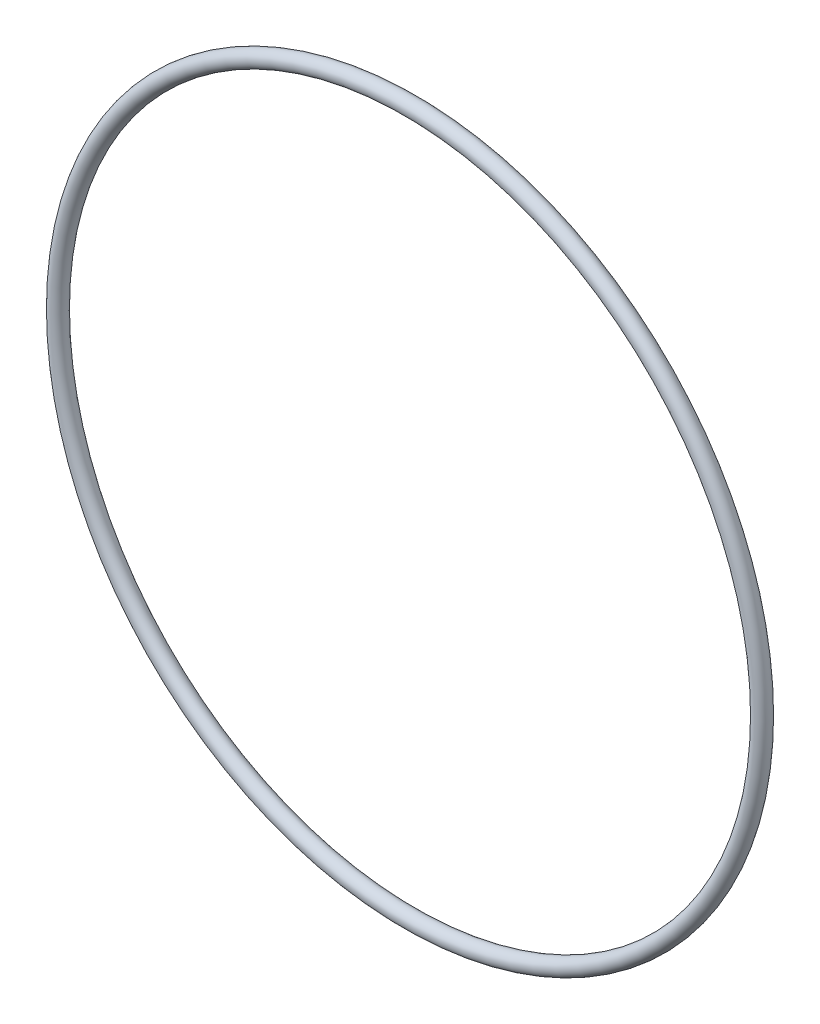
SolidWorks part; units mm, degrees
ref_plane "Front Plane" through (0, 0, 0) normal (0, 0, 1) x (1, 0, 0)
ref_plane "Top Plane" through (0, 0, 0) normal (0, 1, 0) x (1, 0, 0)
ref_plane "Right Plane" through (0, 0, 0) normal (1, 0, 0) x (0, 0, -1)
sketch "Sketch1" plane through (0, 0, 0) normal (0, 1, 0) x (1, 0, 0)
  circle A0 centre (0, 0) radius 0.889
  dimension "D1" = 1.778
sketch "Sketch3" plane through (0, 0, 0) normal (0, 0, 1) x (1, 0, 0)
  circle A0 centre (38.3905, 0) radius 38.3905
  dimension "D1" = 76.7809
sweep "Sweep1" add profiles "Sketch1" path "Sketch3"
